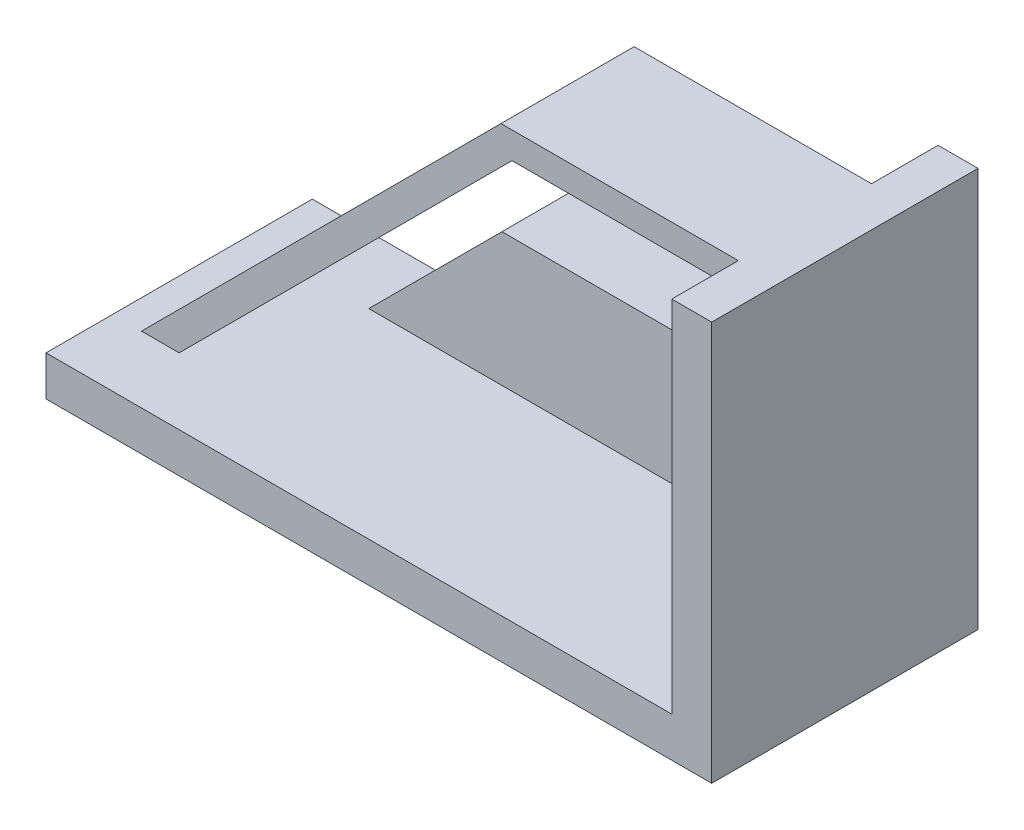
SolidWorks part; units mm, degrees
ref_plane "Front Plane" through (0, 0, 0) normal (0, 0, 1) x (1, 0, 0)
ref_plane "Top Plane" through (0, 0, 0) normal (0, 1, 0) x (1, 0, 0)
ref_plane "Right Plane" through (0, 0, 0) normal (1, 0, 0) x (0, 0, -1)
sketch "Sketch1" plane through (0, 0, 0) normal (0, 0, 1) x (1, 0, 0)
  line L0 (0, 0) -> (50, 0)
  line L1 (50, 0) -> (50, 30)
  dimension "D1" = 50
  dimension "D2" = 30
extrude "Extrude-Thin1" add sketch "Sketch1" along normal mid plane 20 thin
sketch "Sketch2" plane through (0, 0, 0) normal (0, 0, 1) x (1, 0, 0)
  line L0 (47, 28) -> (30, 28)
  line L1 (47, 3) -> (47, 30) construction
  line L2 (30, 28) -> (5, 3)
  line L3 (0, 3) -> (47, 3) construction
  line L4 (47, 30) -> (29.1716, 30)
  line L5 (29.1716, 30) -> (2.1716, 3)
  line L6 (47, 30) -> (47, 28)
  line L7 (2.1716, 3) -> (5, 3)
  line L8 (29.1716, 30) -> (3.5858, 4.4142) construction
  dimension "D2" = 45
  dimension "D3" = 5
  dimension "D1" = 2
extrude "Extrude2" add sketch "Sketch2" along normal mid plane 10
sketch "Sketch4" plane through (47, 0, 0) normal (-1, 0, 0) x (0, 0, 1)
  line L0 (-5, 30) -> (-5, 3) construction
  line L1 (-5, 23) -> (5, 23)
  line L2 (-5, 23) -> (-5, 13)
  line L3 (-5, 13) -> (5, 13)
  line L4 (5, 23) -> (5, 13)
  line L6 (5, 30) -> (5, 3) construction
  line L7 (5, 3) -> (-5, 3) construction
  dimension "D1" = 10
  dimension "D2" = 10
extrude "Extrude3" add sketch "Sketch4" along normal offset from surface (17.7574 mm away) 3
